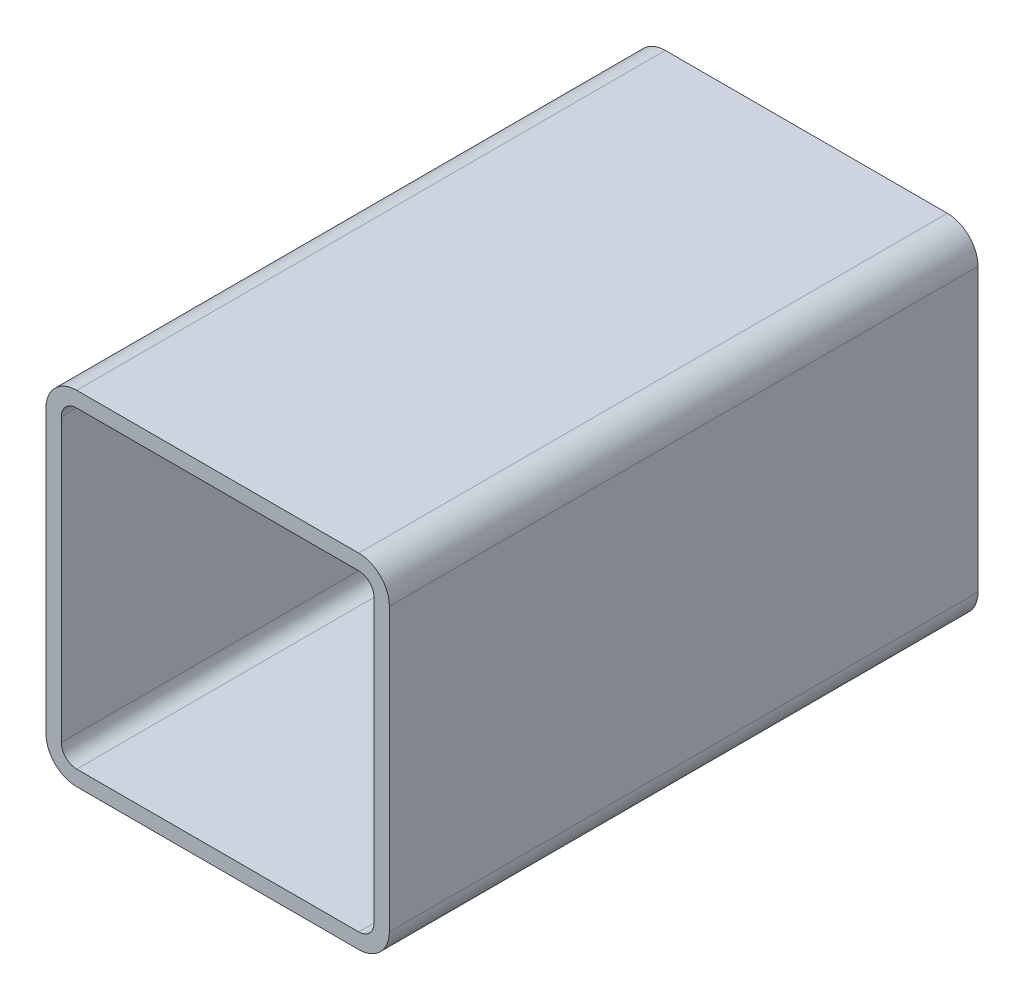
SolidWorks part; units mm, degrees
ref_plane "Front Plane" through (0, 0, 0) normal (0, 0, 1) x (1, 0, 0)
ref_plane "Top Plane" through (0, 0, 0) normal (0, 1, 0) x (1, 0, 0)
ref_plane "Right Plane" through (0, 0, 0) normal (1, 0, 0) x (0, 0, -1)
sketch "Sketch1" plane through (0, 0, 0) normal (0, 0, 1) x (1, 0, 0)
sketch_block_instance "HSS7x7x0.3125-1"
sketch_block "HSS7x7x0.3125"
extrude "Boss-Extrude1" add sketch "Sketch1" along normal blind 304.8
